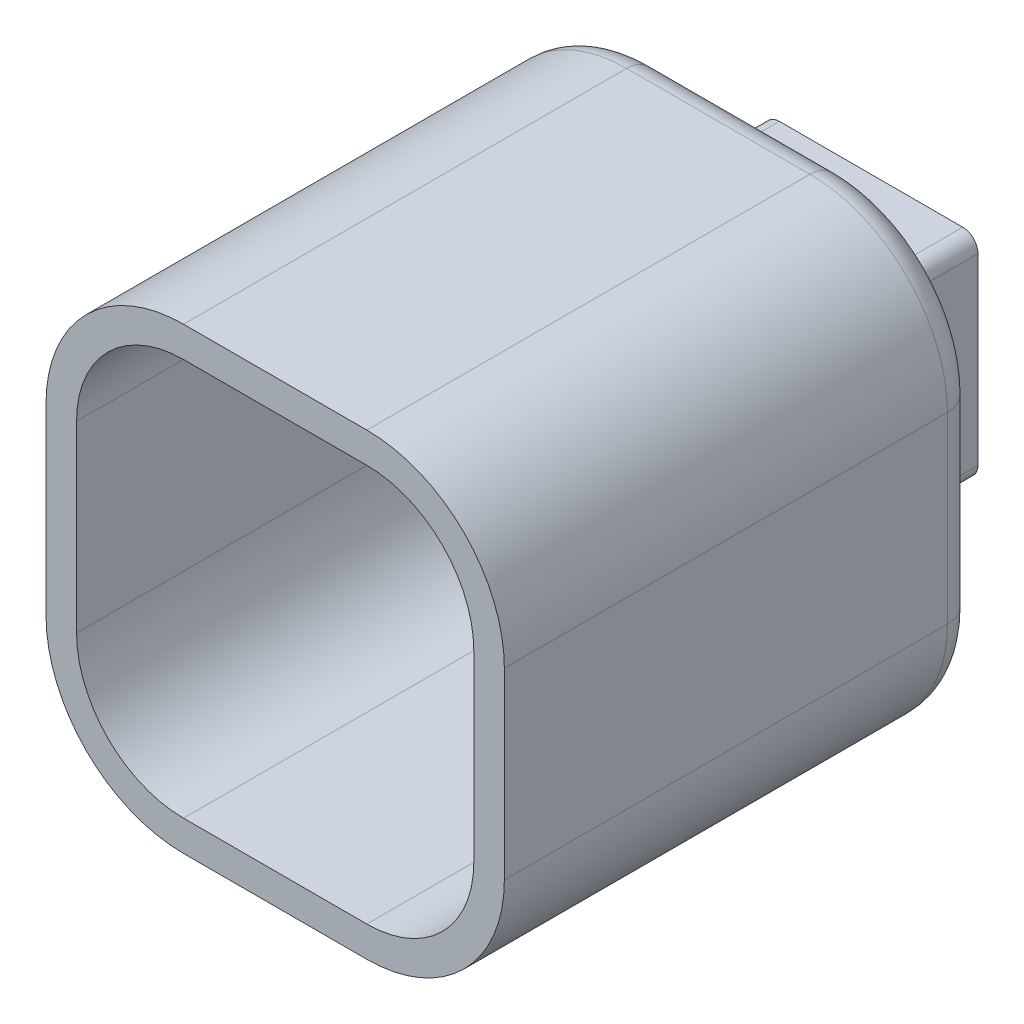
SolidWorks part; units mm, degrees
ref_plane "Front" through (0, 0, 0) normal (0, 0, 1) x (1, 0, 0)
ref_plane "Top" through (0, 0, 0) normal (0, 1, 0) x (1, 0, 0)
ref_plane "Right" through (0, 0, 0) normal (1, 0, 0) x (0, 0, -1)
sketch "Sketch1" plane through (0, 0, 0) normal (0, 0, 1) x (1, 0, 0)
  line L0 (-11.1125, 11.1125) -> (11.1125, 11.1125)
  line L1 (-11.1125, 11.1125) -> (-11.1125, -11.1125)
  line L2 (11.1125, -11.1125) -> (-11.1125, -11.1125)
  line L3 (11.1125, -11.1125) -> (11.1125, 11.1125)
  line L4 (-11.1125, -11.1125) -> (11.1125, 11.1125) construction
  dimension "D1" = 22.225
extrude "Base-Extrude" add sketch "Sketch1" along normal blind 12.7
fillet "Fillet1" radius 1.5875 4 edges at (-11.1125, 11.1125, 6.35) (11.1125, 11.1125, 6.35) (11.1125, -11.1125, 6.35) (-11.1125, -11.1125, 6.35)
sketch "Sketch2" plane through (0, 0, 12.7) normal (0, 0, 1) x (1, 0, 0)
  line L4 (23.8125, -9.525) -> (23.8125, 9.525)
  line L5 (9.525, 23.8125) -> (-9.525, 23.8125)
  line L6 (-23.8125, 9.525) -> (-23.8125, -9.525)
  line L7 (-9.525, -23.8125) -> (9.525, -23.8125)
  line L8 (23.8125, -9.525) -> (23.8125, 9.525)
  line L9 (9.525, 23.8125) -> (-9.525, 23.8125)
  line L10 (-23.8125, 9.525) -> (-23.8125, -9.525)
  line L11 (-9.525, -23.8125) -> (9.525, -23.8125)
  arc A4 (23.8125, 9.525) -> (9.525, 23.8125) centre (9.525, 9.525) ccw
  arc A5 (-9.525, 23.8125) -> (-23.8125, 9.525) centre (-9.525, 9.525) ccw
  arc A6 (-23.8125, -9.525) -> (-9.525, -23.8125) centre (-9.525, -9.525) ccw
  arc A7 (9.525, -23.8125) -> (23.8125, -9.525) centre (9.525, -9.525) ccw
  arc A8 (23.8125, 9.525) -> (9.525, 23.8125) centre (9.525, 9.525) ccw
  arc A9 (-9.525, 23.8125) -> (-23.8125, 9.525) centre (-9.525, 9.525) ccw
  arc A10 (-23.8125, -9.525) -> (-9.525, -23.8125) centre (-9.525, -9.525) ccw
  arc A11 (9.525, -23.8125) -> (23.8125, -9.525) centre (9.525, -9.525) ccw
  dimension "D1" = 12.7
extrude "Boss-Extrude1" add sketch "Sketch2" along normal blind 49.2125
fillet "Fillet2" radius 3.175 8 edges at (19.6278, -19.6278, 12.7) (23.8125, 0, 12.7) (19.6278, 19.6278, 12.7) (0, 23.8125, 12.7) (-19.6278, 19.6278, 12.7) (-23.8125, 0, 12.7) (-19.6278, -19.6278, 12.7) (0, -23.8125, 12.7)
shell "Shell1" thickness 3.175
fillet "Fillet4" radius 1.5875 4 edges at (0, -7.9375, 15.875) (0, 7.9375, 15.875) (-7.9375, 0, 15.875) (7.9375, 0, 15.875)
